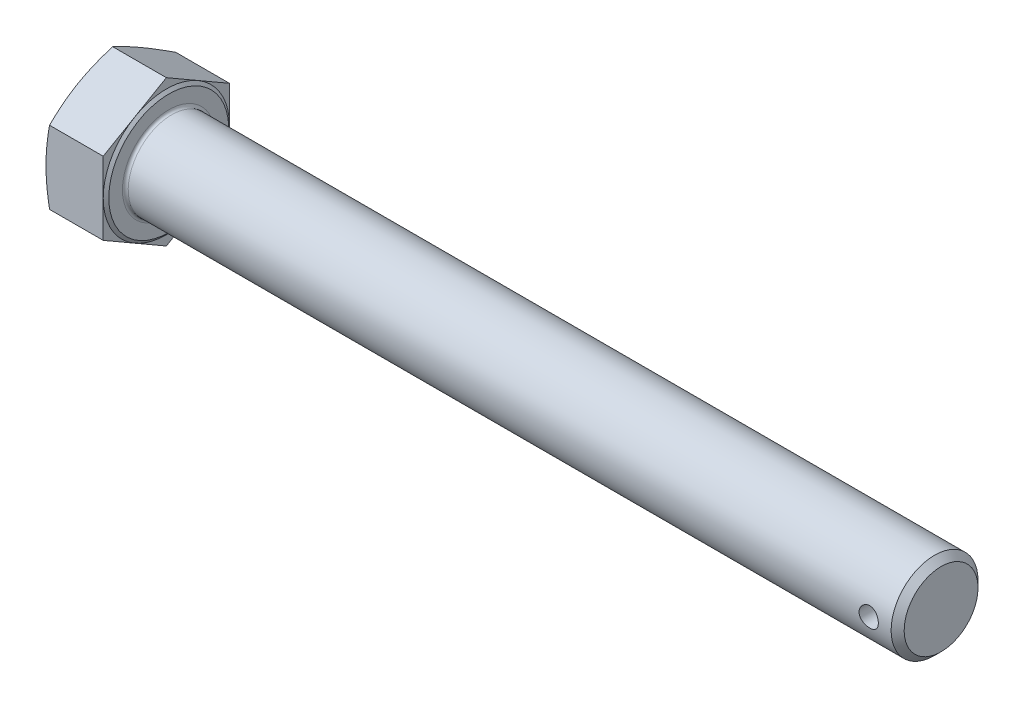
SolidWorks part; units mm, degrees
ref_plane "Front" through (0, 0, 0) normal (0, 0, 1) x (1, 0, 0)
ref_plane "Top" through (0, 0, 0) normal (0, 1, 0) x (1, 0, 0)
ref_plane "Right" through (0, 0, 0) normal (1, 0, 0) x (0, 0, -1)
sketch "Sketch-BaseHead" plane through (0, 0, 0) normal (1, 0, 0) x (0, 0, -1)
  line L1 (0, -15.1035) -> (13.08, -7.5517)
  line L2 (13.08, -7.5517) -> (13.08, 7.5517)
  line L3 (13.08, 7.5517) -> (0, 15.1035)
  line L4 (0, 15.1035) -> (-13.08, 7.5517)
  line L5 (-13.08, 7.5517) -> (-13.08, -7.5517)
  line L6 (-13.08, -7.5517) -> (0, -15.1035)
  circle A0 centre (0, 0) radius 13.08 construction
  dimension "s" = 26.16
extrude "BaseHead" add sketch "Sketch-BaseHead" along normal blind 11.85
sketch "Sketch4" plane through (-0.2646, -5.9169, 0) normal (0, 0, 1) x (0, 1, 0)
  line L0 (5.9169, 3.7369) -> (5.9169, -10.4477) construction
  line L2 (21.0204, -0.2646) -> (18.9969, -0.2646)
  line L4 (18.9969, -0.2646) -> (21.0204, -1.0011)
  line L6 (21.0204, -1.0011) -> (21.0204, -0.2646)
  dimension "D1" = 20
  dimension "D2" = 26.16
revolve "HeadChamfer" cut sketch "Sketch4" angle 360 about L0
sketch "Sketch1" plane through (0, 0, 0) normal (0, 1, 0) x (1, 0, 0)
  line L0 (11.85, 0) -> (12.35, 0)
  line L1 (12.35, 0) -> (12.35, 12.425)
  line L2 (12.35, 12.425) -> (11.85, 13.08)
  line L3 (11.85, 13.08) -> (11.85, 0)
  line L6 (-4.0016, 0) -> (10.1831, 0) construction
  dimension "D1" = 13.08
  dimension "D2" = 12.425
  dimension "D3" = 0.5
revolve "Revolve1" add sketch "Sketch1" angle 360 about axis through (-4.0016, 0, 0) along (1, 0, 0)
ref_plane "Plane2" through (124.35, 0, 0) normal (1, 0, 0) x (0, 0, -1)
sketch "Sketch3" plane through (12.35, 0, 0) normal (1, 0, 0) x (0, 0, -1)
  circle A0 centre (0, 0) radius 9
  dimension "d" = 18
extrude "BaseBody" add sketch "Sketch3" along normal blind 160
chamfer "Chamfer1" distance 1.353 angle 45 1 edges at (172.35, 9, 0)
fillet "HeadFillet" radius 0.6 1 edges at (12.35, -9, 0)
sketch "Sketch5" plane through (0, 0, 0) normal (0, 0, 1) x (1, 0, 0)
  line L2 (12.35, -12.425) -> (12.35, 12.425) construction
  line L3 (170.997, 0) -> (12.95, 0) construction
  circle A0 centre (166.35, 0) radius 2
  dimension "d1" = 4
  dimension "lh" = 154
extrude "Hole" cut sketch "Sketch5" against normal through all and the other way through all
equation "\"D1@Sketch1\" = \"s@Sketch-BaseHead\" / 2"
equation "\"D2@Sketch4\" = \"s@Sketch-BaseHead\""
equation "\"D1@Chamfer1\" = (  \"d@Sketch3\"  -\"D2@ThreadCosmetic1\" ) / 2 "
equation "\"b@ThreadCosmetic1\" = \"l@BaseBody\" - \"lg@Plane2\""
